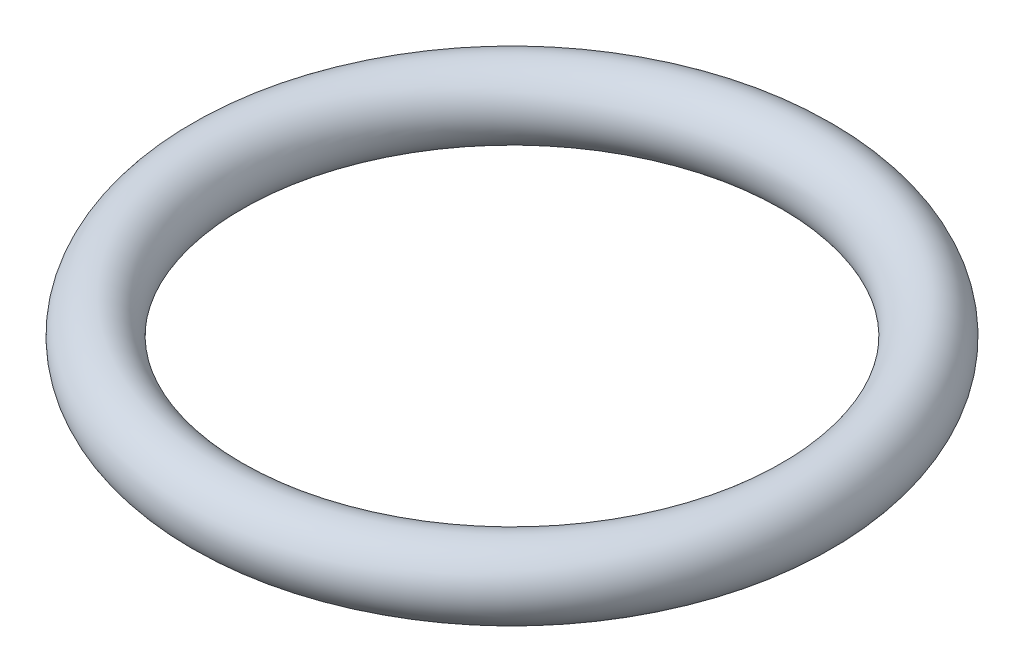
SolidWorks part; units mm, degrees
ref_plane "Face" through (0, 0, 0) normal (0, 0, 1) x (1, 0, 0)
ref_plane "Dessus" through (0, 0, 0) normal (0, 1, 0) x (1, 0, 0)
ref_plane "Droite" through (0, 0, 0) normal (1, 0, 0) x (0, 0, -1)
sketch "Esquisse1" plane through (0, 0, 0) normal (0, 0, 1) x (1, 0, 0)
  line L0 (0, 0) -> (0, 10) construction
  circle A0 centre (14.7, 0) radius 1.75
  dimension "D1" = 3.5
  dimension "D2" = 14.7
revolve "Base-Révolution" add sketch "Esquisse1" angle 360 about L0
